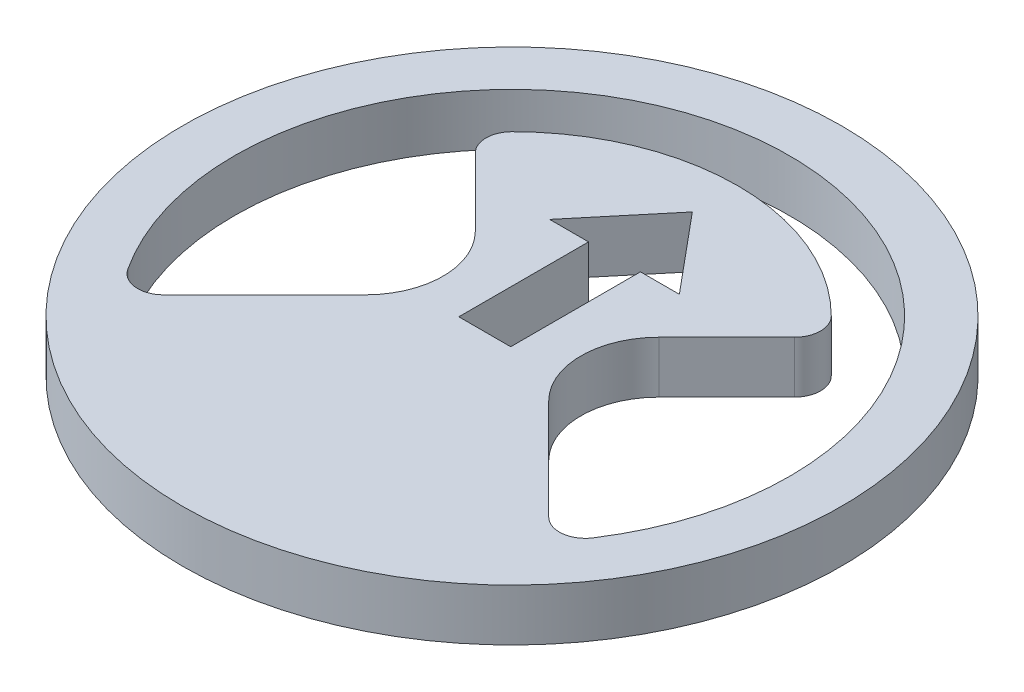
SolidWorks part; units mm, degrees
ref_plane "Front Plane" through (0, 0, 0) normal (0, 0, 1) x (1, 0, 0)
ref_plane "Top Plane" through (0, 0, 0) normal (0, 1, 0) x (1, 0, 0)
ref_plane "Right Plane" through (0, 0, 0) normal (1, 0, 0) x (0, 0, -1)
sketch "Sketch1" plane through (0, 0, 0) normal (0, 1, 0) x (1, 0, 0)
  circle A0 centre (0, 0) radius 12.7
  dimension "D1" = 25.4
extrude "Boss-Extrude1" add sketch "Sketch1" along normal blind 2
sketch "Sketch2" plane through (0, 2, 0) normal (0, 1, 0) x (1, 0, 0)
  line L0 (-12.9016, 12.9016) -> (12.9016, -12.9016) construction
  line L1 (15.1738, 15.1738) -> (-15.1738, -15.1738) construction
  line L2 (0, 0) -> (0, 8.7) construction
  line L3 (-13.6087, 12.1945) -> (12.1945, -13.6087)
  line L4 (14.4667, 15.8809) -> (-15.8809, -14.4667)
  line L5 (-12.1945, 13.6087) -> (13.6087, -12.1945)
  line L6 (15.8809, 14.4667) -> (-14.4667, -15.8809)
  circle A1 centre (0, 0) radius 12.7
  circle A2 centre (0, 0) radius 12.7
  circle A3 centre (0, 0) radius 8.7
  circle A4 centre (0, 0) radius 10.7
  circle A5 centre (0, 0) radius 10.7
  dimension "D4" = 45
  dimension "D1" = 0
  dimension "D2" = 2
  dimension "D3" = 4
  dimension "D5" = 1
  dimension "D6" = 1
extrude "Cut-Extrude1" cut sketch "Sketch2" against normal blind 2.54 contours L3 A3 L4 | L3 A5 L4 A3 | L5 A5 L3 A3 | L4 A5 L5 A3 | L6 A5 L4 A3 | L5 A5 L6 A3 | L5 A3 L6
fillet "Fillet1" radius 3 2 edges at (1.4142, 1, 0) (-1.4142, 1, 0)
fillet "Fillet2" radius 1 4 edges at (8.24, 1, 6.8258) (-8.24, 1, 6.8258) (6.8182, 1, -5.4039) (-6.8182, 1, -5.4039)
sketch "Sketch3" plane through (0, 2, 0) normal (0, 1, 0) x (1, 0, 0)
  line L0 (0, -6.95) -> (0, 6.95) construction
  line L1 (0, 6.95) -> (-2.5, 3.95)
  line L2 (0, 6.95) -> (2.5, 3.95)
  line L3 (-2.5, 3.95) -> (2.5, 3.95)
  line L5 (-1, 3.95) -> (1, 3.95)
  line L6 (-1, 3.95) -> (-1, -1.05)
  line L7 (-1, -1.05) -> (1, -1.05)
  line L8 (1, 3.95) -> (1, -1.05)
  line L9 (-1, 3.95) -> (1, -1.05) construction
  line L10 (-1, -1.05) -> (1, 3.95) construction
  circle A1 centre (0, 0) radius 12.7
  circle A2 centre (0, 0) radius 12.7
  arc A13 (4.9144, 4.9144) -> (-4.9144, 4.9144) centre (0, 0) ccw
  arc A14 (4.9144, 4.9144) -> (-4.9144, 4.9144) centre (0, 0) ccw construction
  point P0 (0, 1.45)
  point P5 (0, 0)
  point P12 (0, 7.0577)
  point P13 (0, 6.3882)
  point P14 (0.5056, -0.4784)
  point P15 (0, 0)
  point P16 (0, 0)
  point P17 (0, 0)
  point P18 (0, 0)
  point P19 (0, -0.3446)
  point P20 (0, 1.2736)
  point P21 (0, 0)
  point P22 (0, 6.95)
  dimension "D1" = 2
  dimension "D2" = 5
  dimension "D3" = 8
  dimension "D4" = 5
  dimension "D5" = 0
  dimension "D6" = 1.75
extrude "Cut-Extrude2" cut sketch "Sketch3" against normal through all contours L8 L3 L6 L7 | L1 L3 L2
